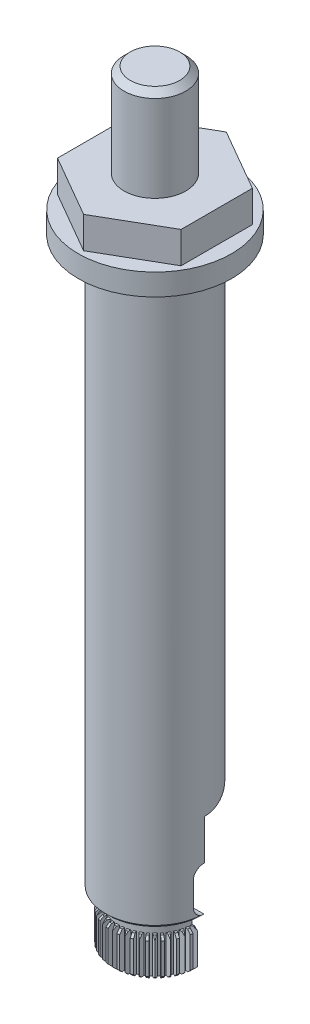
SolidWorks part; units mm, degrees
ref_plane "Plan de face" through (0, 0, 0) normal (0, 0, 1) x (1, 0, 0)
ref_plane "Plan de dessus" through (0, 0, 0) normal (0, 1, 0) x (1, 0, 0)
ref_plane "Plan de droite" through (0, 0, 0) normal (1, 0, 0) x (0, 0, -1)
sketch "Esquisse1" plane through (0, 0, 0) normal (0, 0, 1) x (1, 0, 0)
  line L0 (0, 83.4899) -> (0, -83.9057) construction
  line L5 (0, 108.3) -> (-10, 108.3)
  line L6 (-10, 108.3) -> (-10, 103.2)
  line L7 (-10, 103.2) -> (-12.4, 103.2)
  line L8 (-12.4, 103.2) -> (-12.4, 99.7)
  line L9 (-12.4, 99.7) -> (-8, 99.7)
  line L10 (-8, 99.7) -> (-8, 8)
  line L11 (0, 108.3) -> (0, 0)
  line L14 (-8, 8) -> (-6, 8)
  line L15 (-6, 8) -> (-6, 6)
  line L16 (-6, 6) -> (-6.9, 6)
  line L17 (-6.9, 6) -> (-6.9, 0)
  line L18 (-6.9, 0) -> (0, 0)
  dimension "D6" = 10
  dimension "D7" = 5.1
  dimension "D8" = 12.4
  dimension "D9" = 3.5
  dimension "D10" = 8
  dimension "D11" = 91.7
  dimension "D16" = 6
  dimension "D17" = 2
  dimension "D18" = 6
  dimension "D19" = 6.9
revolve "Révolution1" add sketch "Esquisse1" angle 360 about L0
chamfer "Chanfrein2" distance 0.5 angle 45 3 edges at (0, 8, 8) (0, 6, 6.9) (0, 0, 6.9)
sketch "Esquisse21" plane through (0, 0, 0) normal (0, -1, 0) x (1, 0, 0)
  line L0 (0, 0) -> (0, 11.4257) construction
  line L1 (0, -55) -> (0, 55) construction
  line L2 (0, 6.9) -> (-0.2919, 5.9929)
  line L3 (0, 6.9) -> (0.2919, 5.9929)
  line L4 (-0.6074, 5.9692) -> (-0.7308, 7.1825)
  line L5 (0.6074, 5.9692) -> (0.7308, 7.1825)
  line L6 (-0.7308, 7.1825) -> (0.7308, 7.1825)
  arc A0 (-0.2919, 5.9929) -> (-0.6074, 5.9692) centre (0, 0) ccw
  arc A1 (0.6074, 5.9692) -> (0.2919, 5.9929) centre (0, 0) ccw
  dimension "D2" = 12
  dimension "D3" = 17.84
  dimension "D4" = 17.84
  dimension "D5" = 5.81
  dimension "D6" = 5.81
extrude "Enlèv. mat.-Extru.7" cut sketch "Esquisse21" against normal blind 6
pattern_circular "Répétition circulaire1" count 24 every 15 about axis through (0, 0, 0) along (0, 1, 0) of "Enlèv. mat.-Extru.7"
sketch "Esquisse10" plane through (0, 108.3, 0) normal (0, 1, 0) x (-1, 0, 0)
  line L0 (0, -15.1677) -> (0, 13.7053) construction
  line L1 (-14.6428, 0) -> (15.4302, 0) construction
  line L4 (0, 11.547) -> (-10, 5.7735)
  line L5 (-10, 5.7735) -> (-10, -5.7735)
  line L6 (-10, -5.7735) -> (0, -11.547)
  line L7 (0, -11.547) -> (10, -5.7735)
  line L8 (10, -5.7735) -> (10, 5.7735)
  line L9 (10, 5.7735) -> (0, 11.547)
  circle A0 centre (0, 0) radius 10 construction
  dimension "D1" = 20
extrude "Extrusion2" add sketch "Esquisse10" against normal up to surface (5.1 mm away)
hole_wizard "Trou taraudé M6" positions "Esquisse3D2" profile "Esquisse19" tap size "M6" standard "ISO"
sketch3d "Esquisse3D2"
  point P0 (0, 0, 0)
  point P4 (0, 0, 0)
sketch "Esquisse19" plane through (0, 0, 0) normal (1, 0, 0) x (0, 0, -1)
  line L0 (0, 0) -> (0, 21.5022)
  line L1 (0, 21.5022) -> (2.5, 20)
  line L2 (2.5, 20) -> (2.5, 16)
  line L3 (2.5, 16) -> (3, 16)
  line L4 (3, 16) -> (3, 0)
  line L5 (3, 0) -> (0, 0)
  line L10 (0, 21.5022) -> (-2.5, 20) construction
  line L11 (0, -6.35) -> (0, 107.95) construction
  dimension "Diamètre du trou pour taraudage" = 5
  dimension "Profondeur du trou pour taraudage" = 20
  dimension "Diamètre principal du filetage" = 6
  dimension "Profondeur du filetage" = 16
  dimension "Angle de pointe" = 118
sketch "Esquisse20" plane through (0, 0, 0) normal (1, 0, 0) x (0, 0, -1)
  line L0 (0, 28.3785) -> (0, -2.2725) construction
  line L1 (0, 13.64) -> (0, -13.64) construction
  line L2 (-6.2032, 14) -> (6.5681, 14) construction
  line L3 (-6.2032, 10) -> (7.3891, 10) construction
  line L4 (-1.6, 14) -> (-1.6, 10)
  line L5 (1.6, 14) -> (1.6, 10)
  arc A0 (-1.6, 10) -> (1.6, 10) centre (0, 10) ccw
  arc A1 (1.6, 14) -> (-1.6, 14) centre (0, 14) ccw
  dimension "D1" = 3.2
  dimension "D2" = 3.2
  dimension "D3" = 4
  dimension "D4" = 10
extrude "Enlèv. mat.-Extru.6" cut sketch "Esquisse20" against normal mid plane 40
hole_wizard "Trou taraudé M82" positions "Esquisse25" profile "Esquisse24" tap size "M8" standard "ISO"
sketch "Esquisse25" plane through (0, 105.6, 0) normal (0, 1, 0) x (-1, 0, 0)
  point P0 (0, 0)
sketch "Esquisse24" plane through (0, 105.6, 0) normal (1, 0, 0) x (0, 0, 1)
  line L0 (0, 0) -> (0, 16.2929)
  line L1 (0, 16.2929) -> (3.4, 14.25)
  line L2 (3.4, 14.25) -> (3.4, 12)
  line L3 (3.4, 12) -> (4, 12)
  line L4 (4, 12) -> (4, 0)
  line L5 (4, 0) -> (0, 0)
  line L10 (0, 16.2929) -> (-3.4, 14.25) construction
  line L11 (0, -6.35) -> (0, 107.95) construction
  dimension "Diamètre du trou pour taraudage" = 6.8
  dimension "Profondeur du trou pour taraudage" = 14.25
  dimension "Diamètre principal du filetage" = 8
  dimension "Profondeur du filetage" = 12
  dimension "Angle de pointe" = 118
sketch "Esquisse26" plane through (0, 108.3, 0) normal (0, 1, 0) x (1, 0, 0)
  circle A0 centre (0, 0) radius 5
  dimension "D1" = 10
extrude "Extrusion3" add sketch "Esquisse26" along normal blind 15
chamfer "Chanfrein3" distance 1 angle 45 1 edges at (0, 123.3, 5)
sketch "Esquisse27" plane through (0, 0, 0) normal (0, 0, 1) x (1, 0, 0)
  line L0 (-8, 99.7) -> (-8, 15.6) construction
  spline S0 degree 3 poles (-20.5158, -4.9117) (-13.1067, 16.7675) (-5.3429, 24.3355) (-0.6881, 22.982) (4.0243, 24.2263) (15.3199, 18.7767) (14.7767, -9.2365) (-20.5158, -4.9117) (-13.1067, 16.7675) (-5.3429, 24.3355) knots -0.793913 -0.50899 -0.269376 0 0.043088 0.078257 0.155055 0.206087 0.49101 0.730624 1 1.043088 1.078257 1.155055 only from (-8, 21.5898) to (-8, 21.5898)
extrude "Enlèv. mat.-Extru.8" cut sketch "Esquisse27" against normal blind 16
